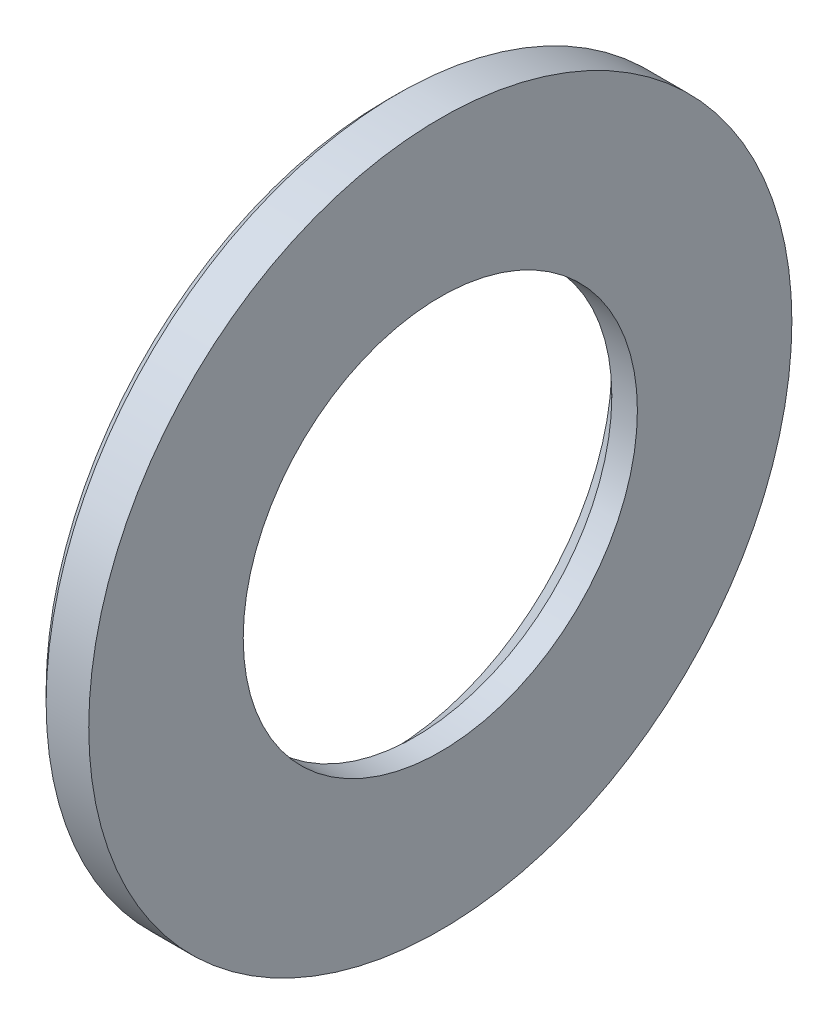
SolidWorks part; units mm, degrees
ref_plane "Plane1" through (0, 0, 0) normal (0, 0, 1) x (1, 0, 0)
ref_plane "Plane2" through (0, 0, 0) normal (0, 1, 0) x (1, 0, 0)
ref_plane "Plane3" through (0, 0, 0) normal (1, 0, 0) x (0, 0, -1)
other "Configuration Table"
sketch "Sketch1" plane through (0, 0, 0) normal (0, 0, 1) x (1, 0, 0)
  line L0 (-34.925, 0) -> (9.525, 0) construction
  line L1 (0, 18.5) -> (0, 33)
  line L2 (0, 33) -> (-4, 33)
  line L3 (-5, 32) -> (-5, 21.1)
  line L4 (-2.4, 18.5) -> (0, 18.5)
  line L5 (-5, 32) -> (-4, 33)
  line L7 (-2.4, 18.5) -> (-5, 21.1)
  dimension "D1" = 45
  dimension "D2" = 45
  dimension "Thickness" = 5
  dimension "Inside_dia" = 37
  dimension "Outside_dia" = 66
  dimension "OD_ch_ht" = 1
  dimension "ID_ch_ht" = 2.6
revolve "Base-Revolve" add sketch "Sketch1" angle 360 about L0
